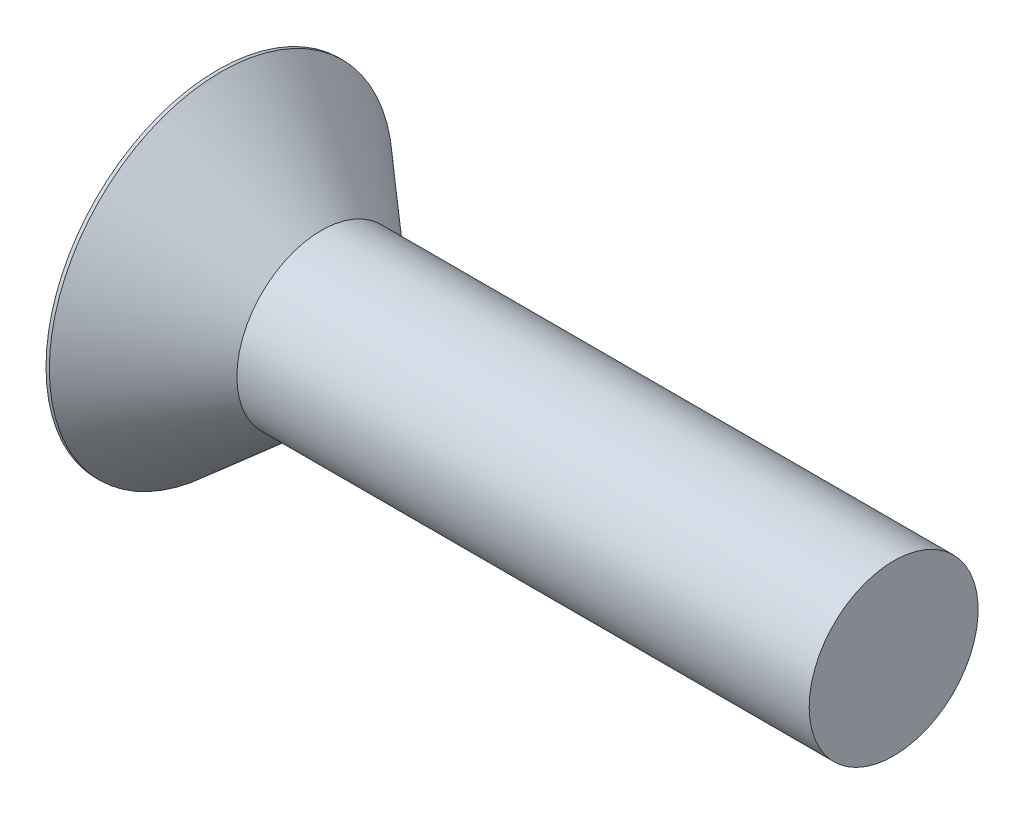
SolidWorks part; units mm, degrees
ref_plane "Plane1" through (0, 0, 0) normal (0, 0, 1) x (1, 0, 0)
ref_plane "Plane2" through (0, 0, 0) normal (0, 1, 0) x (1, 0, 0)
ref_plane "Plane3" through (0, 0, 0) normal (1, 0, 0) x (0, 0, -1)
sketch "BodySke" plane through (0, 0, 0) normal (0, 0, 1) x (1, 0, 0)
  line L0 (0, 0) -> (0, 9.6774)
  line L1 (0, 9.6774) -> (0.1881, 9.6774)
  line L2 (5.842, 4.7625) -> (38.1, 4.7625)
  line L3 (38.1, 4.7625) -> (38.1, 0)
  line L4 (38.1, 0) -> (0, 0)
  line L5 (-6.35, 0) -> (82.55, 0) construction
  line L6 (5.842, -4.7625) -> (38.1, -4.7625) construction
  line L7 (0.1881, -9.6774) -> (5.842, -4.7625) construction
  line L8 (0.1881, 9.6774) -> (5.842, 4.7625)
  line L9 (0, -9.6774) -> (0.1881, -9.6774) construction
  line L10 (7.4295, 6.35) -> (7.4295, -3.175) construction
  line L11 (6.35, 6.35) -> (6.35, -3.175) construction
  dimension "Diameter" = 9.525
  dimension "Length" = 38.1
  dimension "Head_ht" = 5.842
  dimension "Head_dia" = 19.3548
  dimension "Head_ang" = 82
  dimension "D6" = 0.1881
  dimension "Advance" = 1.5875
  dimension "Thread_nom" = 31.75
revolve "Base-Revolve" add sketch "BodySke" angle 360 about L5
sketch "Sketch2" plane through (0, 0, 0) normal (-1, 0, 0) x (0, 0, 1)
  line L0 (-9.6774, -1.1938) -> (9.6774, -1.1938)
  line L1 (-9.6774, -1.1938) -> (-9.6774, 1.1938)
  line L2 (9.6774, 1.1938) -> (-9.6774, 1.1938)
  line L3 (9.6774, 1.1938) -> (9.6774, -1.1938)
  dimension "D1" = 1.1938
  dimension "Slot_width" = 2.3876
  dimension "D2" = 19.3548
  dimension "D3" = 9.6774
extrude "Slot" [suppressed] cut sketch "Sketch2" against normal blind 2.2352
sketch "Sketch3" plane through (0, 0, 0) normal (-1, 0, 0) x (0, 0, 1)
  line L0 (-1.0922, 6.6421) -> (1.0922, 6.6421)
  line L1 (1.0922, 6.6421) -> (1.0922, -6.6421)
  line L2 (1.0922, -6.6421) -> (-1.0922, -6.6421)
  line L3 (-1.0922, -6.6421) -> (-1.0922, 6.6421)
  dimension "D1" = 6.6421
  dimension "Cross_dia" = 13.2842
  dimension "D2" = 1.0922
  dimension "Cross_width" = 2.1844
ref_plane "Plane4" through (7.9756, 0, 0) normal (-1, 0, 0) x (0, 0, 1)
sketch "Sketch4" plane through (7.9756, 0, 0) normal (-1, 0, 0) x (0, 0, 1)
  line L0 (-0.5461, 0.5461) -> (0.5461, 0.5461)
  line L3 (0.5461, 0.5461) -> (0.5461, -0.5461)
  line L4 (0.5461, -0.5461) -> (-0.5461, -0.5461)
  line L5 (-0.5461, -0.5461) -> (-0.5461, 0.5461)
  dimension "D1" = 1.0922
  dimension "D2" = 1.0922
  dimension "D3" = 0.5461
  dimension "D4" = 0.5461
loft "Cross" cut profiles "Sketch3", "Sketch4"
pattern_circular "CirPattern1" count 2 every 90 about axis through (0, 0, 0) along (1, 0, 0) of "Cross"
sketch "ThdSchSke" plane through (0, 0, 0) normal (0, 0, 1) x (1, 0, 0)
  line L0 (7.4295, -3.9624) -> (6.8693, -4.7625)
  line L1 (7.4295, -3.9624) -> (7.9898, -4.7625)
  line L2 (7.9898, -4.7625) -> (7.9898, -5.9531)
  line L3 (-3.175, 0) -> (5.1513, 0) construction
  line L5 (7.9898, -5.9531) -> (6.8693, -5.9531)
  line L6 (6.8693, -5.9531) -> (6.8693, -4.7625)
  line L7 (0, 9.6774) -> (0, -9.6774) construction
  dimension "Thread_minor" = 7.9248
  dimension "Diameter" = 9.525
  dimension "Start" = 7.4295
  dimension "SideAngle" = 55
  dimension "VeeAngle" = 70
  dimension "Overcut" = 11.9063
revolve "ThreadSchematic" [suppressed] cut sketch "ThdSchSke" angle 360 about L3
pattern_linear "ThdSchPat" [suppressed]
equation "\"D1@Sketch3\" = \"Cross_dia@Sketch3\" / 2"
equation "\"D2@Sketch3\" = \"Cross_width@Sketch3\" / 2"
equation "\"D1@Sketch4\" = \"Cross_width@Sketch3\" *.5"
equation "\"D2@Sketch4\" = \"D1@Sketch4\""
equation "\"D4@Sketch4\" = \"D2@Sketch4\" / 2"
equation "\"D3@Sketch4\" = \"D1@Sketch4\" / 2"
equation "\"D1@Sketch2\" = \"Slot_width@Sketch2\" / 2"
equation "\"D2@Sketch2\" = \"Head_dia@BodySke\""
equation "\"D3@Sketch2\" = \"D2@Sketch2\" / 2"
equation "\"Thread_length@ThreadCosmetic\" = ((sgn( (\"Length@BodySke\" - \"Advance@BodySke\" - \"Head_ht@BodySke\" ) - \"Thread_nom@BodySke\" )-1)*( (\"Length@BodySke\" - \"Advance@BodySke\" - \"Head_ht@BodySke\" ) - \"Thread_"
equation "\"Thread_minor@ThdSchSke\" = \"Thread_minor@ThreadCosmetic\""
equation "\"Diameter@ThdSchSke\" = \"Diameter@BodySke\""
equation "\"Overcut@ThdSchSke\" = \"Diameter@BodySke\" * 1.25"
equation "\"Start@ThdSchSke\" = 0.000001 + \"Length@BodySke\" - \"Thread_length@ThreadCosmetic\"  '---Countersunk---"
equation "\"Num_threads@ThdSchPat\" = int( \"Thread_length@ThreadCosmetic\" / \"Advance@BodySke\" + 0.999 )  + 1"
equation "\"Advance@ThdSchPat\" = \"Thread_length@ThreadCosmetic\" /  (\"Num_threads@ThdSchPat\" - 1) 'relax it"
